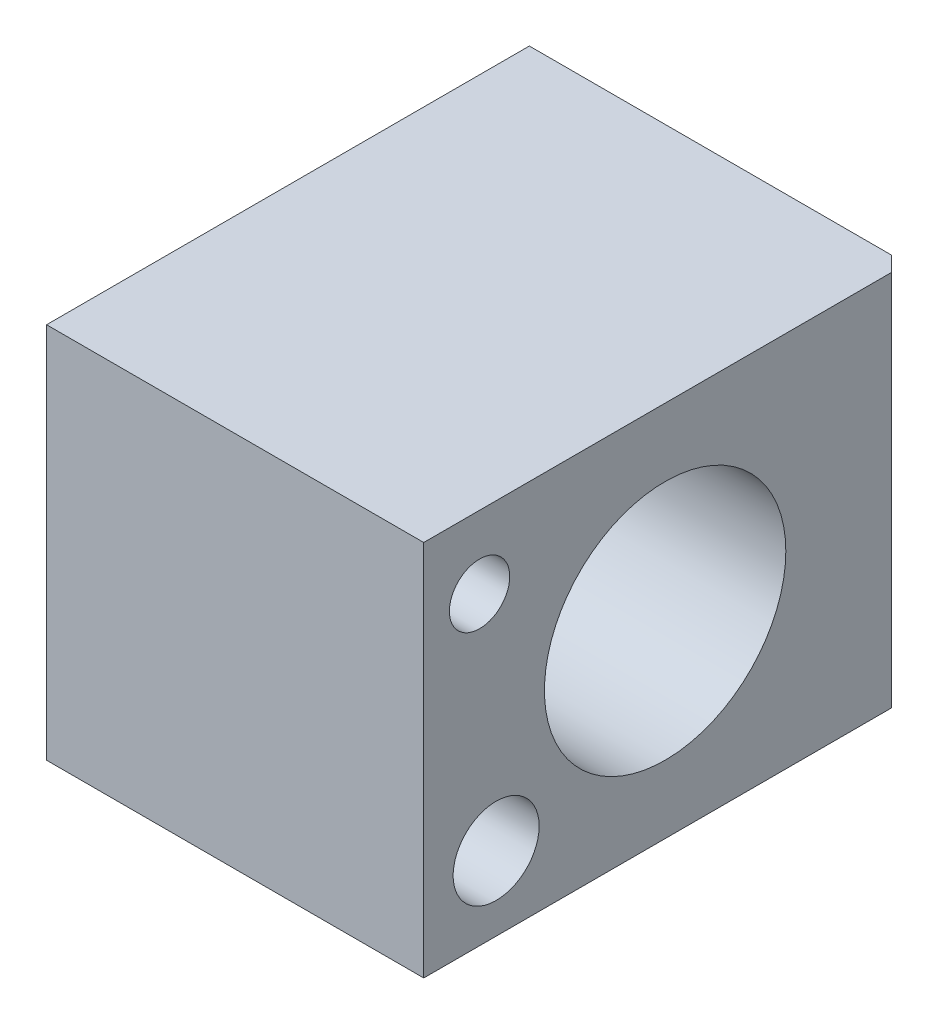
SolidWorks part; units mm, degrees
ref_plane "Face" through (0, 0, 0) normal (0, 0, 1) x (1, 0, 0)
ref_plane "Dessus" through (0, 0, 0) normal (0, 1, 0) x (1, 0, 0)
ref_plane "Droite" through (0, 0, 0) normal (1, 0, 0) x (0, 0, -1)
sketch "Esquisse1" plane through (0, 0, 0) normal (1, 0, 0) x (0, 0, -1)
  line L0 (-29.3487, 0) -> (38.7403, 0) construction
  line L1 (0, 31.501) -> (0, -28.7618) construction
  line L3 (-16, 12.5) -> (16, 12.5)
  line L4 (-16, 12.5) -> (-16, -12.5)
  line L5 (-16, -12.5) -> (16, -12.5)
  line L6 (16, 12.5) -> (16, -12.5)
  dimension "D1" = 32
  dimension "D2" = 25
extrude "Base-Extrusion" add sketch "Esquisse1" along normal mid plane 25
sketch "Esquisse2" plane through (12.5, 0, 0) normal (1, 0, 0) x (0, 0, -1)
  circle A0 centre (0, 0) radius 8
  circle A1 centre (-11.2, -7.6) radius 2.85
  circle A2 centre (-12.3, 7.7) radius 2
  dimension "D1" = 16
  dimension "D4" = 5.7
  dimension "D5" = 4
  dimension "D2" = 11.2
  dimension "D3" = 7.6
  dimension "D6" = 12.3
  dimension "D7" = 7.7
extrude "Enlèv. mat.-Extru.1" cut sketch "Esquisse2" against normal up to next
chamfer "Chanfrein1" distance 1 angle 45 1 edges at (12.5, 0, -16)
